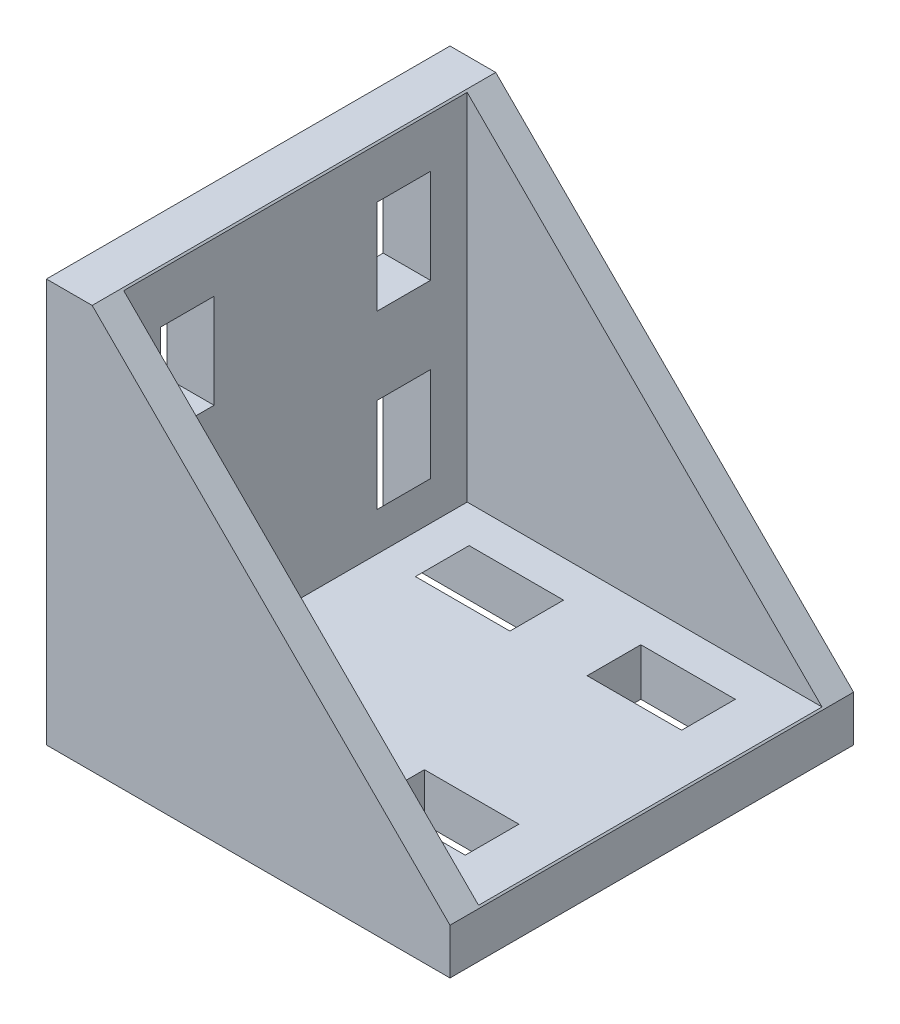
SolidWorks part; units mm, degrees
ref_plane "Front Plane" through (0, 0, 0) normal (0, 0, 1) x (1, 0, 0)
ref_plane "Top Plane" through (0, 0, 0) normal (0, 1, 0) x (1, 0, 0)
ref_plane "Right Plane" through (0, 0, 0) normal (1, 0, 0) x (0, 0, -1)
sketch "Sketch1" plane through (0, 0, 0) normal (0, 0, 1) x (1, 0, 0)
  line L0 (0, 0) -> (0, 47)
  line L1 (47, 5.3259) -> (5.3259, 47)
  line L4 (5.3259, 47) -> (0, 47)
  line L5 (47, 0) -> (0, 0)
  line L7 (47, 5.3259) -> (47, 0)
  dimension "D1" = 37
  dimension "C" = 47
  dimension "B" = 47
extrude "Boss-Extrude1" add sketch "Sketch1" along normal mid plane 47
sketch "Sketch2" plane through (0, 0, 0) normal (0, 0, 1) x (1, 0, 0)
  line L0 (5.5, 46.8259) -> (5.5, 5.5)
  line L1 (5.5, 5.5) -> (46.8259, 5.5)
  line L2 (5.5, 46.8259) -> (46.8259, 5.5)
  line L3 (0, 0) -> (0, 47) construction
  line L4 (47, 0) -> (0, 0) construction
  line L5 (47, 5.3259) -> (5.3259, 47) construction
  dimension "D1" = 5.5
  dimension "D2" = 5.5
extrude "Cut-Extrude1" cut sketch "Sketch2" against normal mid plane 40
sketch "Sketch3" plane through (0, 0, 0) normal (0, 0, 1) x (1, 0, 0)
  line L0 (47, 5.3259) -> (5.3259, 47) construction
  line L1 (0, 21) -> (5.5, 21)
  line L2 (0, 21) -> (0, 4.5)
  line L3 (0, 4.5) -> (5.5, 10)
  line L4 (5.5, 21) -> (5.5, 10)
  line L5 (10, 5.5) -> (21, 5.5)
  line L6 (10, 5.5) -> (4.5, 0)
  line L7 (4.5, 0) -> (21, 0)
  line L8 (21, 5.5) -> (21, 0)
  line L9 (5.5, 46.8259) -> (5.5, 5.5) construction
  line L10 (47, 0) -> (0, 0) construction
  line L11 (0, 0) -> (0, 47) construction
  line L12 (0, 41) -> (5.5, 41)
  line L13 (0, 41) -> (0, 30)
  line L14 (0, 30) -> (5.5, 30)
  line L15 (5.5, 41) -> (5.5, 30)
  line L16 (30, 0) -> (41, 0)
  line L17 (30, 0) -> (30, 5.5)
  line L18 (30, 5.5) -> (41, 5.5)
  line L19 (41, 0) -> (41, 5.5)
  line L20 (5.5, 5.5) -> (46.8259, 5.5) construction
  dimension "D1" = 21
  dimension "D2" = 11
  dimension "D3" = 21
  dimension "D4" = 11
  dimension "D5" = 9
  dimension "D6" = 11
  dimension "D7" = 9
  dimension "D8" = 11
extrude "Cut-Extrude2" cut sketch "Sketch3" against normal mid plane 6.25 from offset 12.6
sketch "Sketch4" plane through (0, 0, 0) normal (0, 0, 1) x (1, 0, 0)
  line L0 (0, 47) -> (0, 0) construction
  line L1 (1.2115, 2.3429) -> (0, 1.2348) construction
  line L2 (0.7481, -2.4705) -> (-0.171, -1.5368)
  line L3 (0, 3.5355) -> (-2.4705, 0.7481)
  line L4 (-2.4705, 0.7481) -> (-1.5368, -0.171)
  line L5 (-1.5368, -0.171) -> (0, 1.2348)
  line L6 (0, 1.2348) -> (0, 3.5355)
  line L7 (-0.171, -1.5368) -> (1.2348, 0)
  line L8 (0, 0) -> (0, 47) construction
  line L9 (-2.0036, 0.2885) -> (0, 2.3239) construction
  line L10 (1.2348, 0) -> (3.5355, 0)
  line L11 (3.5355, 0) -> (0.7481, -2.4705)
  line L12 (0, 46.3) -> (0, 43.9992)
  line L13 (0, 43.9992) -> (-1.5368, 42.5934)
  line L14 (-1.5368, 42.5934) -> (-2.4705, 43.5125)
  line L15 (-2.4705, 43.5125) -> (0, 46.3)
  line L16 (-2.0036, 43.053) -> (0, 45.0884) construction
  line L17 (0, 45.0884) -> (0.6057, 45.7037) construction
  line L18 (47, 5.3259) -> (5.3259, 47) construction
  line L19 (26.163, 26.163) -> (0, 0) construction
  line L20 (0, 46.3) -> (1.2115, 45.1074) construction
  line L21 (0, 43.9992) -> (1.2115, 45.1074) construction
  line L22 (0, 3.5355) -> (1.2115, 2.3429) construction
  line L23 (43.9992, 0) -> (42.5934, -1.5368)
  line L24 (0.6057, 2.9392) -> (0, 2.3239) construction
  line L25 (42.5934, -1.5368) -> (43.5125, -2.4705)
  line L26 (46.3, 0) -> (43.9992, 0)
  line L27 (43.5125, -2.4705) -> (46.3, 0)
  line L28 (-2.4705, 0.7481) -> (-2.4705, 43.5125) construction
  dimension "D1" = 1.7
  dimension "D2" = 5
  dimension "D3" = 6
  dimension "D4" = 1.6001
  dimension "D5" = 0.7
  dimension "D6" = 1.2
  dimension "D7" = 2.4705
extrude "Boss-Extrude2" add sketch "Sketch4" along normal mid plane 6 from offset 12.6
mirror "Mirror1" about plane through (0, 0, 0) normal (0, 0, 1) of "Boss-Extrude2", "Cut-Extrude2"
